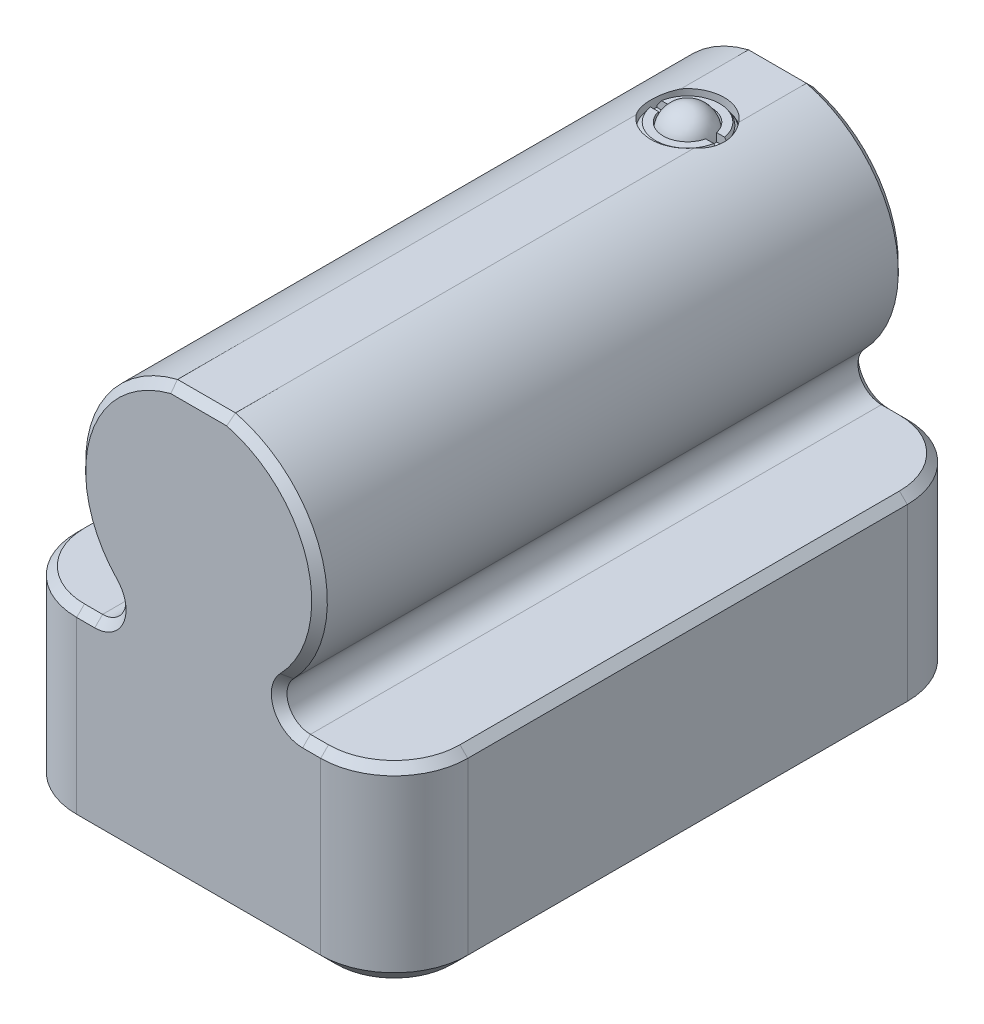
SolidWorks part; units mm, degrees
other "<4-48x187 SETSCREW>-<Imported1>"
other "<4-48 DETENT>-<Imported2>"
other "<4-48 DETENT>-<Imported1>"
ref_plane "Front Plane" through (0, 0, 0) normal (0, 0, 1) x (1, 0, 0)
ref_plane "Top Plane" through (0, 0, 0) normal (0, 1, 0) x (1, 0, 0)
ref_plane "Right Plane" through (0, 0, 0) normal (1, 0, 0) x (0, 0, -1)
sketch "Sketch1" plane through (0, 0, 0) normal (0, 0, 1) x (1, 0, 0)
  line L0 (-6.35, 0) -> (-6.35, 6.2992)
  line L1 (-6.35, 6.2992) -> (-3.3751, 6.2992)
  line L2 (3.3751, 6.2992) -> (6.35, 6.2992)
  line L3 (6.35, 6.2992) -> (6.35, 0)
  line L4 (6.35, 0) -> (-6.35, 0)
  line L5 (0, 0) -> (0, 10.3124) construction
  line L6 (0.9402, 14.1224) -> (-0.9402, 14.1224)
  arc A0 (-3.3751, 6.2992) -> (-2.8263, 7.5899) centre (-3.3751, 7.0612) ccw
  arc A1 (-2.8263, 7.5899) -> (-0.9402, 14.1224) centre (0, 10.3124) cw
  arc A2 (2.8263, 7.5899) -> (3.3751, 6.2992) centre (3.3751, 7.0612) ccw
  arc A3 (0.9402, 14.1224) -> (2.8263, 7.5899) centre (0, 10.3124) cw
  dimension "D3" = 3.9243
  dimension "D5" = 0.762
  dimension "D6" = 5.2261
  dimension "D8" = 1.8805
  dimension "D9" = 4.0132
  dimension "D1" = 6.2992
  dimension "D2" = 12.7
  dimension "D10" = 10.3124
  dimension "D11" = 14.1224
extrude "Boss-Extrude1" add sketch "Sketch1" along normal mid plane 19.05
fillet "Fillet1" radius 2.3876 4 edges at (-6.35, 3.1496, -9.525) (-6.35, 3.1496, 9.525) (6.35, 3.1496, -9.525) (6.35, 3.1496, 9.525)
chamfer "Chamfer1" distance 0.508 angle 45 8 edges at (0, 0, -9.525) (-5.6507, 0, -8.8257) (5.6507, 0, -8.8257) (-6.35, 0, 0) (6.35, 0, 0) (-5.6507, 0, 8.8257) (5.6507, 0, 8.8257) (0, 0, 9.525)
chamfer "Chamfer2" distance 0.254 angle 45 20 edges at (-5.6507, 6.2992, -8.8257) (-6.35, 6.2992, 0) (-3.6687, 6.2992, -9.525) (-5.6507, 6.2992, 8.8257) (-2.6738, 6.763, -9.525) (-3.6687, 6.2992, 9.525) (-3.7703, 11.4009, -9.525) (-2.6738, 6.763, 9.525) (2.6738, 6.763, -9.525) (-3.7703, 11.4009, 9.525) (3.6687, 6.2992, -9.525) (2.6738, 6.763, 9.525) (5.6507, 6.2992, -8.8257) (3.6687, 6.2992, 9.525) (6.35, 6.2992, 0) (5.6507, 6.2992, 8.8257) (0, 14.1224, -9.525) (0, 14.1224, 9.525) (3.7703, 11.4009, -9.525) (3.7703, 11.4009, 9.525)
hole_wizard "#10-32 Tapped Hole1" positions "Sketch2" profile "Sketch3" tap size "#10-32" standard "ANSI Inch"
sketch "Sketch2" plane through (0, 0, 0) normal (0, -1, 0) x (-1, 0, 0)
  point P0 (0, 0)
sketch "Sketch3" plane through (0, 0, 0) normal (1, 0, 0) x (0, 0, -1)
  line L0 (0, 0) -> (0, 10.1033)
  line L1 (0, 10.1033) -> (2.0193, 8.89)
  line L2 (2.0193, 8.89) -> (2.0193, 0)
  line L5 (2.0193, 0) -> (0, 0)
  line L10 (0, 10.1033) -> (-2.0193, 8.89) construction
  line L11 (0, -6.35) -> (0, 107.95) construction
  dimension "Tap Drill Dia." = 4.0386
  dimension "Tap Drill Depth" = 8.89
  dimension "Drill Angle" = 118
hole_wizard "#4-48 Tapped Hole1" positions "Sketch4" profile "Sketch5" tap size "#4-48" standard "ANSI Inch"
sketch "Sketch4" plane through (0, 0, 0) normal (0, -1, 0) x (-1, 0, 0)
  point P0 (0, 6.35)
  dimension "D1" = 6.35
sketch "Sketch5" plane through (0, 0, -6.35) normal (1, 0, 0) x (0, 0, -1)
  line L0 (0, 0) -> (0, 14.1224)
  line L1 (0, 14.1224) -> (1.1874, 14.1224)
  line L2 (1.1874, 14.1224) -> (1.1874, 0)
  line L5 (1.1874, 0) -> (0, 0)
  line L11 (0, -6.35) -> (0, 107.95) construction
  point P3 (0, 14.5288)
  dimension "Thru Tap Drill Dia." = 2.3749
  dimension "Thru Tap Drill Depth" = 14.1224
inserted part "4-48 DETENT"
move or copy body "Body-Move/Copy2" placed by mates yes
inserted part "4-48x187 SETSCREW"
move or copy body "Body-Move/Copy4" placed by mates yes
